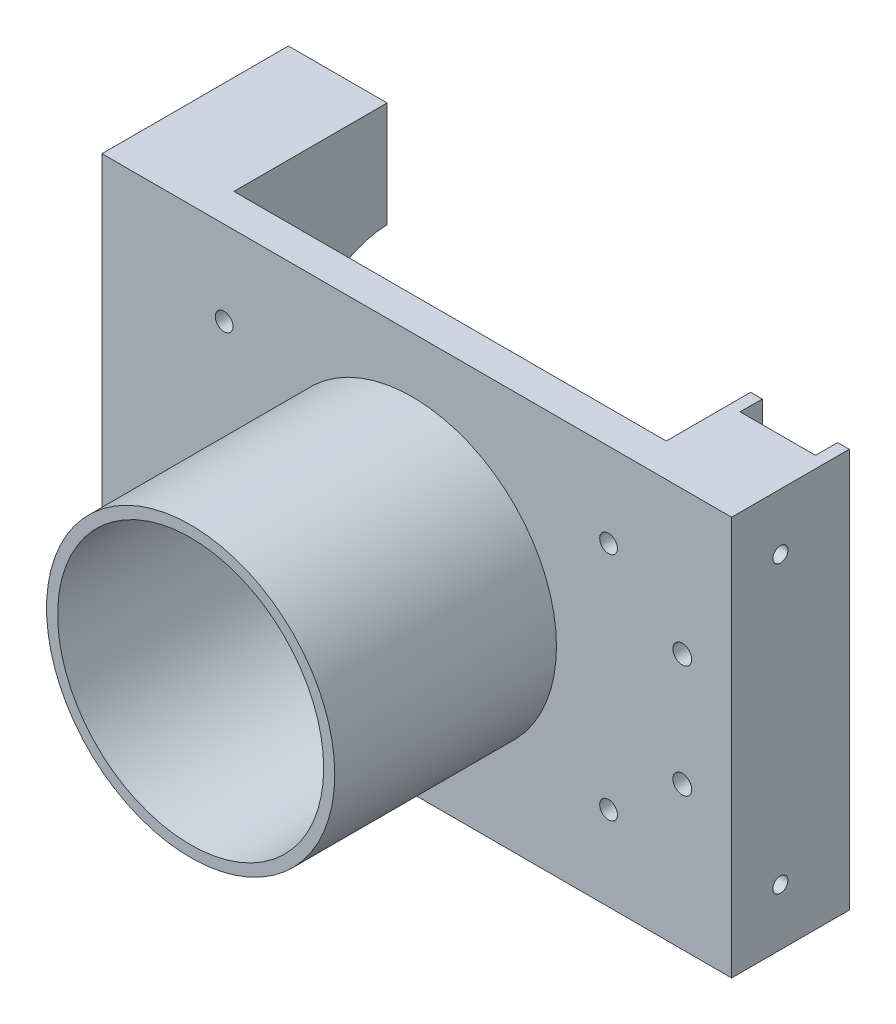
SolidWorks part; units mm, degrees
ref_plane "Plan de face" through (0, 0, 0) normal (0, 0, 1) x (1, 0, 0)
ref_plane "Plan de dessus" through (0, 0, 0) normal (0, 1, 0) x (1, 0, 0)
ref_plane "Plan de droite" through (0, 0, 0) normal (1, 0, 0) x (0, 0, -1)
sketch "Esquisse1" plane through (0, 0, 0) normal (0, 0, 1) x (1, 0, 0)
  line L1 (0, 0) -> (284, 0)
  line L2 (0, 0) -> (0, 180)
  line L3 (0, 180) -> (284, 180)
  line L4 (284, 0) -> (284, 180)
  dimension "D1" = 284
  dimension "D2" = 180
extrude "Extrusion1" add sketch "Esquisse1" along normal blind 53.07
sketch "Esquisse2" plane through (0, 0, 53.07) normal (0, 0, 1) x (1, 0, 0)
  line L0 (284, 0) -> (284, 180) construction
  line L3 (284, 180) -> (0, 180) construction
  circle A0 centre (140, 90) radius 65
  circle A1 centre (140, 90) radius 60
  dimension "D3" = 120
  dimension "D4" = 130
  dimension "D1" = 144
  dimension "D2" = 90
extrude "Extrusion3" add sketch "Esquisse2" along normal blind 100 separate body
draft "Dépouille1" type of draft neutral plane draft angle 1 faces to draft 1 parameters "D1"=1
sketch "Esquisse3" plane through (0, 0, 0) normal (0, 0, -1) x (-1, 0, 0)
  line L0 (0, 0) -> (-284, 0) construction
  line L1 (-44.5, 180) -> (-239.5, 180)
  line L2 (-44.5, 180) -> (-44.5, 18)
  line L3 (-44.5, 18) -> (-239.5, 18)
  line L4 (-239.5, 180) -> (-239.5, 18)
  line L5 (0, 180) -> (0, 0) construction
  dimension "D1" = 162
  dimension "D2" = 195
  dimension "D3" = 18
  dimension "D4" = 44.5
extrude "Enlèv. mat.-Extru.1" cut sketch "Esquisse3" against normal blind 38.07
sketch "Esquisse16" plane through (0, 0, 53.07) normal (0, 0, 1) x (1, 0, 0)
  line L0 (284, 180) -> (0, 180) construction
  line L1 (0, 180) -> (0, 0) construction
  circle A0 centre (55.1, 142) radius 4
  circle A1 centre (55.1, 38) radius 4
  dimension "D3" = 8
  dimension "D1" = 38
  dimension "D2" = 55.1
  dimension "D4" = 104
extrude "Enlèv. mat.-Extru.15" cut sketch "Esquisse16" against normal up to next (15 mm away)
pattern_linear "Répétition linéaire3" count 2 spacing 173.4 along (1, 0, 0) of "Enlèv. mat.-Extru.15"
sketch "Esquisse17" plane through (0, 0, 53.07) normal (0, 0, 1) x (1, 0, 0)
  line L0 (284, 0) -> (284, 180) construction
  line L1 (284, 180) -> (0, 180) construction
  circle A0 centre (261.75, 115.4) radius 4.25
  circle A1 centre (261.75, 64.6) radius 4.25
  dimension "D3" = 8.5
  dimension "D1" = 22.25
  dimension "D2" = 64.6
  dimension "D4" = 50.8
sketch "Esquisse12" plane through (0, 0, 0) normal (0, 0, -1) x (-1, 0, 0)
  line L0 (-284, 180) -> (-239.5, 180) construction
  line L1 (-278.75, 180) -> (-244.75, 180)
  line L2 (-278.75, 180) -> (-278.75, 40)
  line L3 (-278.75, 40) -> (-244.75, 40)
  line L4 (-244.75, 180) -> (-244.75, 40)
  line L5 (-284, 0) -> (-284, 180) construction
  dimension "D1" = 34
  dimension "D2" = 140
  dimension "D3" = 5.25
extrude "Enlèv. mat.-Extru.4" cut sketch "Esquisse12" against normal blind 10
sketch "Esquisse14" plane through (0, 0, 0) normal (-1, 0, 0) x (0, 0, 1)
  line L1 (0, 180) -> (-31.035, 180)
  line L2 (0, 180) -> (0, 0)
  line L3 (0, 0) -> (-31.035, 0)
  line L4 (-31.035, 180) -> (-31.035, 0)
  dimension "D1" = 31.035
extrude "Extrusion4" add sketch "Esquisse14" against normal up to surface (44.5 mm away)
sketch "Esquisse13" plane through (0, 0, 0) normal (-1, 0, 0) x (0, 0, 1)
  line L0 (153.07, 90) -> (53.07, 90) construction
  line L1 (0, 180) -> (0, 0) construction
  circle A0 centre (-32.93, 90) radius 42.5
  dimension "D2" = 85
  dimension "D1" = 32.93
extrude "Enlèv. mat.-Extru.5" cut sketch "Esquisse13" against normal up to next (44.5 mm away)
sketch "Esquisse15" plane through (0, 0, 0) normal (-1, 0, 0) x (0, 0, 1)
  line L1 (9.2749, 95) -> (14.2749, 95)
  line L2 (9.2749, 95) -> (9.2749, 85)
  line L3 (9.2749, 85) -> (14.2749, 85)
  line L4 (14.2749, 95) -> (14.2749, 85)
  arc A1 (-31.035, 47.5423) -> (-31.035, 132.4577) centre (-32.93, 90) ccw construction
  dimension "D1" = 5
  dimension "D2" = 10
  dimension "D3" = 5
extrude "Enlèv. mat.-Extru.14" cut sketch "Esquisse15" against normal up to next (44.5 mm away)
extrude "Enlèv. mat.-Extru.18" cut sketch "Esquisse17" against normal up to next (43.07 mm away)
hole_wizard "Trou taraudé M82" positions "Esquisse21" profile "Esquisse20" tap size "M8" standard "ISO"
sketch "Esquisse21" plane through (0, 0, -31.035) normal (0, 0, -1) x (-1, 0, 0)
  line L0 (0, 47.5423) -> (0, 0) construction
  line L2 (0, 47.5423) -> (-44.5, 47.5423) construction
  point P0 (-22.25, 23.7723)
  dimension "D1" = 22.25
  dimension "D2" = 23.77
sketch "Esquisse20" plane through (22.25, 23.7723, -31.035) normal (1, 0, 0) x (0, 1, 0)
  line L0 (0, 0) -> (0, 21.7929)
  line L1 (0, 21.7929) -> (3.4, 19.75)
  line L2 (3.4, 19.75) -> (3.4, 0)
  line L5 (3.4, 0) -> (0, 0)
  line L10 (0, 21.7929) -> (-3.4, 19.75) construction
  line L11 (0, -6.35) -> (0, 107.95) construction
  dimension "Diamètre du trou pour taraudage" = 6.8
  dimension "Profondeur du trou pour taraudage" = 19.75
  dimension "Angle de pointe" = 118
pattern_linear "Répétition linéaire4" count 2 spacing 132.46 along (0, 1, 0) of "Trou taraudé M82"
hole_wizard "Trou taraudé M81" positions "Esquisse23" profile "Esquisse24" tap size "M8" standard "ISO"
sketch "Esquisse23" plane through (284, 0, 0) normal (1, 0, 0) x (0, 0, -1)
  line L0 (-53.07, 0) -> (-53.07, 180) construction
  line L1 (-53.07, 180) -> (0, 180) construction
  point P0 (-31.07, 154.5)
  dimension "D1" = 22
  dimension "D2" = 25.5
sketch "Esquisse24" plane through (284, 154.5, 31.07) normal (0, 1, 0) x (0, 0, -1)
  line L0 (0, 0) -> (0, 24.2929)
  line L1 (0, 24.2929) -> (3.4, 22.25)
  line L2 (3.4, 22.25) -> (3.4, 0)
  line L5 (3.4, 0) -> (0, 0)
  line L10 (0, 24.2929) -> (-3.4, 22.25) construction
  line L11 (0, -6.35) -> (0, 107.95) construction
  dimension "Diamètre du trou pour taraudage" = 6.8
  dimension "Profondeur du trou pour taraudage" = 22.25
  dimension "Angle de pointe" = 118
pattern_linear "Répétition linéaire5" count 2 spacing 129 along (0, -1, 0) of "Trou taraudé M81"
